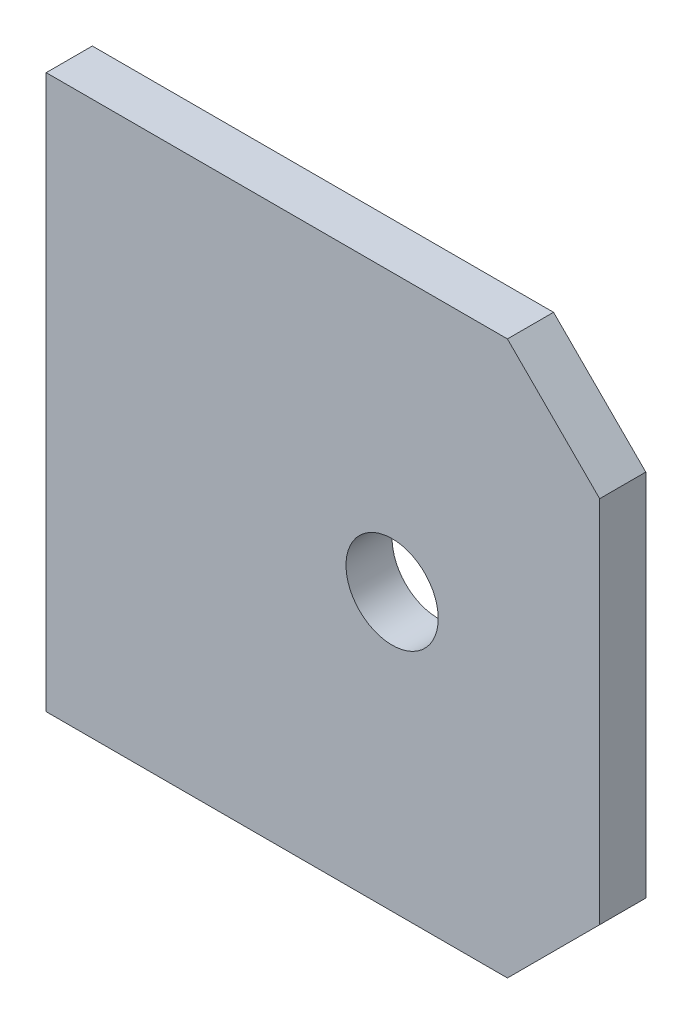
SolidWorks part; units mm, degrees
ref_plane "Face" through (0, 0, 0) normal (0, 0, 1) x (1, 0, 0)
ref_plane "Dessus" through (0, 0, 0) normal (0, 1, 0) x (1, 0, 0)
ref_plane "Droite" through (0, 0, 0) normal (1, 0, 0) x (0, 0, -1)
sketch "Esquisse1" plane through (0, 0, 0) normal (0, 0, 1) x (1, 0, 0)
  line L0 (100, 0) -> (120, -20)
  line L1 (0, 0) -> (100, 0)
  line L2 (0, 0) -> (0, -120)
  line L3 (0, -120) -> (100, -120)
  line L4 (120, -20) -> (120, -100)
  line L5 (120, -100) -> (100, -120)
  circle A0 centre (75, -60) radius 10
  point P1 (120, -120)
  point P3 (120, 0)
  dimension "D3" = 20
  dimension "D1" = 120
  dimension "D2" = 120
  dimension "D5" = 20
  dimension "D6" = 20
  dimension "D4" = 60
  dimension "D7" = 75
extrude "Base-Extrusion" add sketch "Esquisse1" along normal blind 10
